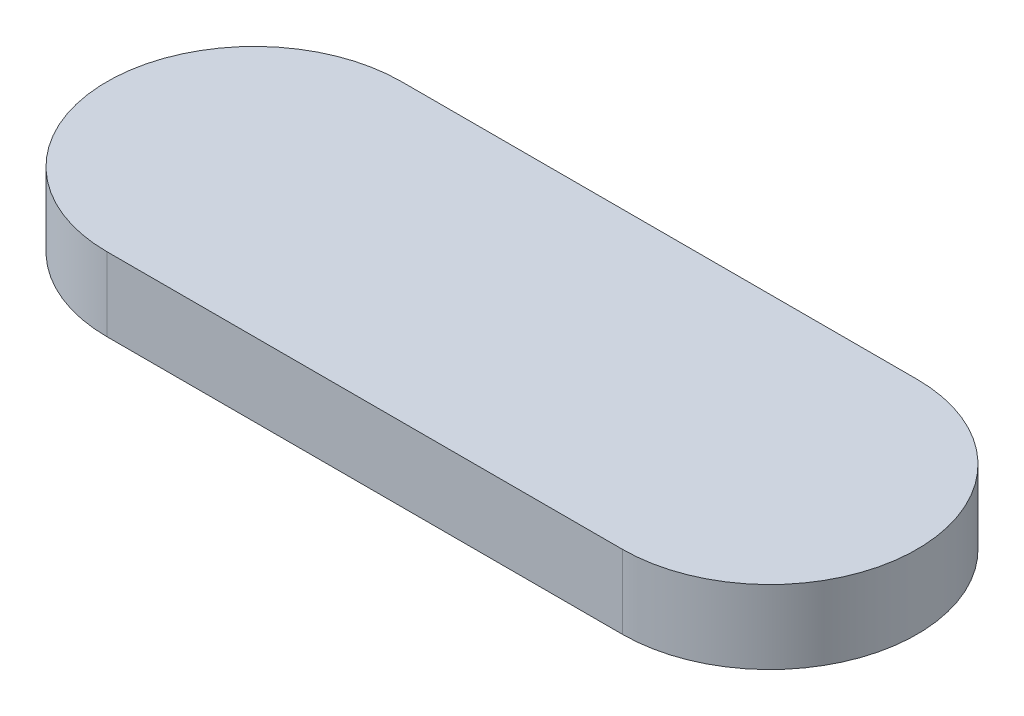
SolidWorks part; units mm, degrees
ref_plane "Front Plane" through (0, 0, 0) normal (0, 0, 1) x (1, 0, 0)
ref_plane "Top Plane" through (0, 0, 0) normal (0, 1, 0) x (1, 0, 0)
ref_plane "Right Plane" through (0, 0, 0) normal (1, 0, 0) x (0, 0, -1)
sketch "Sketch1" plane through (0, 0, 0) normal (0, 1, 0) x (1, 0, 0)
  line L0 (0, 0) -> (35, 0) construction
  line L1 (0, -10) -> (35, -10)
  line L2 (0, 10) -> (35, 10)
  arc A0 (0, -10) -> (0, 10) centre (0, 0) cw
  arc A1 (35, -10) -> (35, 10) centre (35, 0) ccw
  dimension "D1" = 35
  dimension "D2" = 10
  dimension "D3" = 10
extrude "Extrude1" add sketch "Sketch1" along normal blind 5
